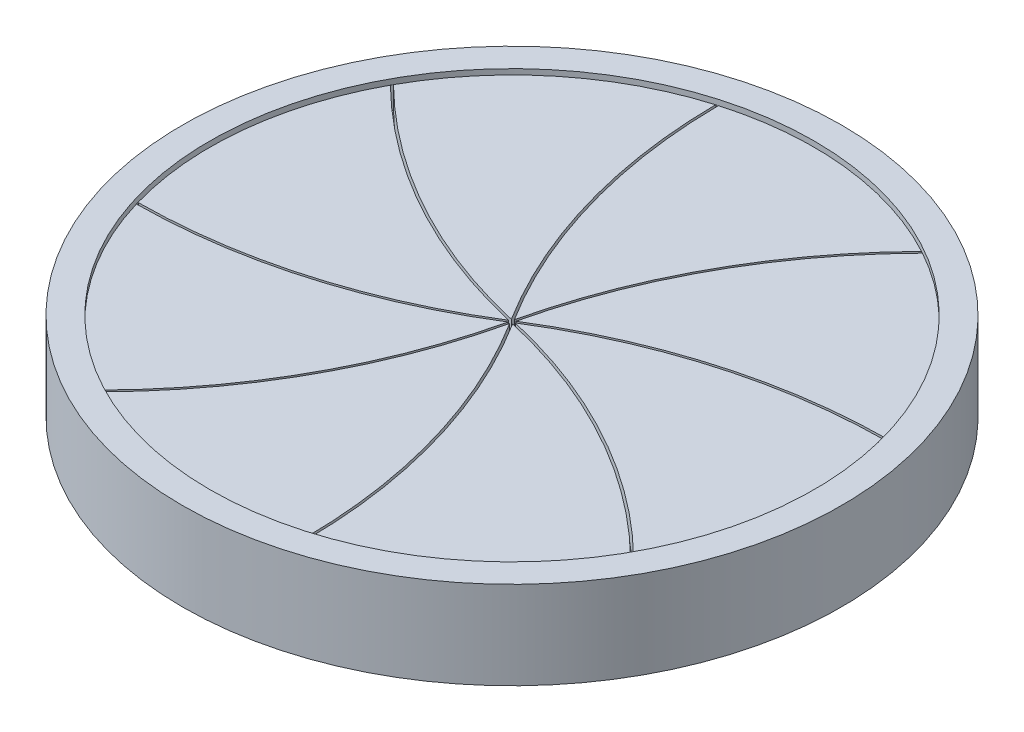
SolidWorks part; units mm, degrees
ref_plane "Front" through (0, 0, 0) normal (0, 0, 1) x (1, 0, 0)
ref_plane "Top" through (0, 0, 0) normal (0, 1, 0) x (1, 0, 0)
ref_plane "Right" through (0, 0, 0) normal (1, 0, 0) x (0, 0, -1)
sketch "Sketch1" plane through (0, 0, 0) normal (0, 1, 0) x (1, 0, 0)
  circle A0 centre (0, 0) radius 30
  dimension "D1" = 60
extrude "Boss-Extrude1" add sketch "Sketch1" along normal blind 8
sketch "Sketch2" plane through (0, 8, 0) normal (0, 1, 0) x (1, 0, 0)
  circle A0 centre (0, 0) radius 27.5
  dimension "D1" = 55
extrude "Cut-Extrude1" cut sketch "Sketch2" against normal blind 0.5
sketch "Sketch3" plane through (0, 7.5, 0) normal (0, 1, 0) x (1, 0, 0)
  arc A0 (0, 0) -> (26.3916, 7.7288) centre (26.7063, -42.2702) cw
  circle A1 centre (0, 0) radius 27.5 construction
  circle A2 centre (0, 0) radius 27.5 construction
  arc A3 (0, 0) -> (24.1267, -13.1966) centre (-11.0053, -48.7738) cw
  arc A4 (0, 0) -> (7.7288, -26.3916) centre (-42.2702, -26.7063) cw
  arc A5 (0, 0) -> (-13.1966, -24.1267) centre (-48.7738, 11.0053) cw
  arc A6 (0, 0) -> (-26.3916, -7.7288) centre (-26.7063, 42.2702) cw
  arc A7 (0, 0) -> (-24.1267, 13.1966) centre (11.0053, 48.7738) cw
  arc A8 (0, 0) -> (-7.7288, 26.3916) centre (42.2702, 26.7063) cw
  arc A9 (0, 0) -> (13.1966, 24.1267) centre (48.7738, -11.0053) cw
  point P24 (0, 0)
  dimension "D2" = 8
extrude "Cut-Extrude-Thin1" cut sketch "Sketch3" against normal blind 2 thin contours A6 | A7 | A8 | A9 | A0 | A3 | A4 | A5
